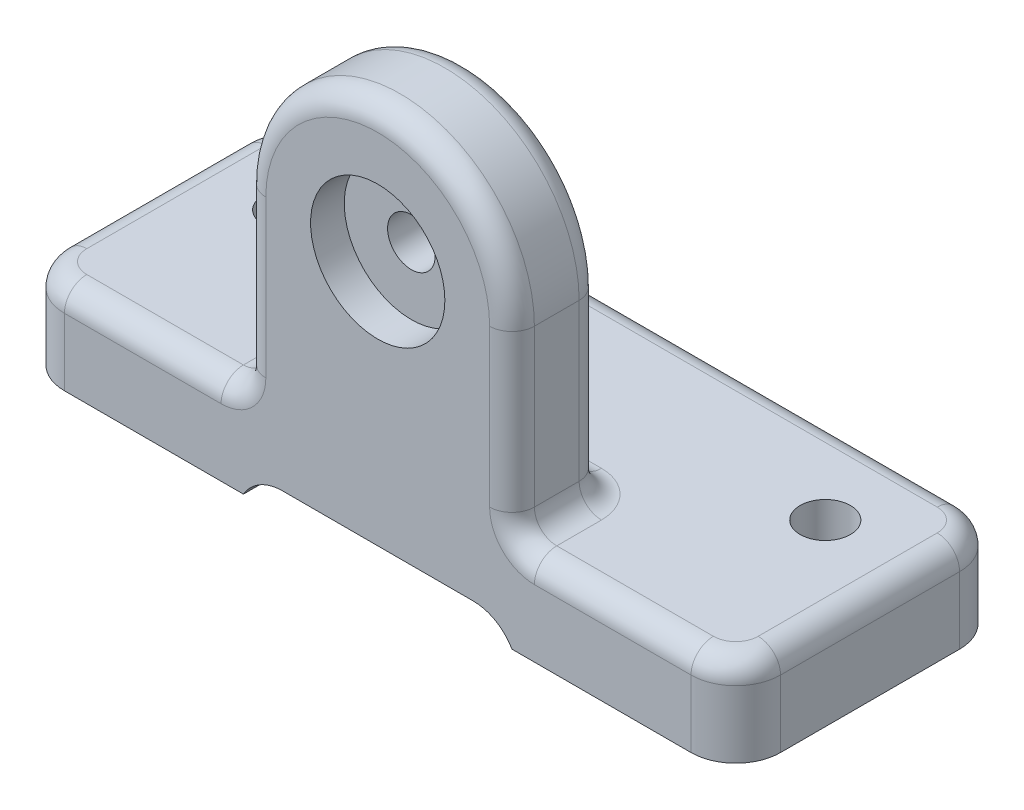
SolidWorks part; units mm, degrees
ref_plane "Front Plane" through (0, 0, 0) normal (0, 0, 1) x (1, 0, 0)
ref_plane "Top Plane" through (0, 0, 0) normal (0, 1, 0) x (1, 0, 0)
ref_plane "Right Plane" through (0, 0, 0) normal (1, 0, 0) x (0, 0, -1)
sketch "Sketch1" plane through (0, 0, 0) normal (0, 1, 0) x (1, 0, 0)
  line L1 (0, 0) -> (101.6, 0)
  line L2 (0, 0) -> (0, 38.1)
  line L3 (0, 38.1) -> (101.6, 38.1)
  line L4 (101.6, 0) -> (101.6, 38.1)
  dimension "D1" = 101.6
  dimension "D2" = 38.1
extrude "Base Plate" add sketch "Sketch1" along normal blind 12.7
sketch "Sketch2" plane through (0, 0, 0) normal (0, 0, 1) x (1, 0, 0)
  line L0 (31.75, 0) -> (31.75, 38.1)
  line L1 (0, 0) -> (101.6, 0) construction
  line L2 (69.85, 38.1) -> (69.85, 0)
  line L3 (69.85, 0) -> (31.75, 0)
  line L4 (0, 12.7) -> (0, 0) construction
  arc A0 (31.75, 38.1) -> (69.85, 38.1) centre (50.8, 38.1) cw
  dimension "D1" = 19.05
  dimension "D2" = 50.8
  dimension "D3" = 38.1
extrude "Vert Boss" add sketch "Sketch2" against normal blind 12.7
hole_wizard "CBORE for 1/4 Hex Head Bolt1" positions "Sketch4" profile "Sketch3" counterbore size "1/4" standard "Ansi Inch"
sketch "Sketch4" plane through (0, 0, 0) normal (0, 0, 1) x (1, 0, 0)
  point P0 (50.8, 38.1)
sketch "Sketch3" plane through (50.8, 38.1, 0) normal (1, 0, 0) x (0, -1, 0)
  line L0 (0, 0) -> (0, 38.1)
  line L1 (0, 38.1) -> (3.3782, 38.1)
  line L3 (3.3782, 38.1) -> (3.3782, 4.7752)
  line L4 (3.3782, 4.7752) -> (9.525, 4.7752)
  line L5 (9.525, 4.7752) -> (9.525, 0)
  line L7 (9.525, 0) -> (0, 0)
  line L11 (0, -6.35) -> (0, 107.95) construction
  dimension "Thru Hole Dia." = 6.7564
  dimension "Thru Hole Depth" = 38.1
  dimension "C'Bore Dia." = 19.05
  dimension "C'Bore Depth" = 4.7752
sketch "Sketch5" plane through (0, 0, 0) normal (0, 0, 1) x (1, 0, 0)
  line L0 (0, 0) -> (101.6, 0) construction
  line L1 (31.75, 0) -> (69.85, 0)
  line L2 (31.75, 0) -> (31.75, 3.175)
  line L3 (31.75, 3.175) -> (69.85, 3.175)
  line L4 (69.85, 0) -> (69.85, 3.175)
  line L5 (31.75, 38.1) -> (31.75, 12.7) construction
  line L6 (69.85, 12.7) -> (69.85, 38.1) construction
  dimension "D1" = 3.175
extrude "Slot" cut sketch "Sketch5" against normal through all
hole_wizard "9/32 Holes" positions "Sketch7" profile "Sketch6" hole size "9/32" standard "Ansi Inch"
sketch "Sketch7" plane through (0, 12.7, 0) normal (0, 1, 0) x (-1, 0, 0)
  line L0 (0, -38.1) -> (0, 0) construction
  line L1 (-101.6, 0) -> (-101.6, -38.1) construction
  line L2 (-101.6, -38.1) -> (0, -38.1) construction
  point P0 (-88.9, -25.4)
  point P1 (-12.7, -25.4)
  dimension "D1" = 12.7
  dimension "D2" = 12.7
  dimension "D3" = 12.7
sketch "Sketch6" plane through (88.9, 12.7, -25.4) normal (1, 0, 0) x (0, 0, 1)
  line L0 (0, 0) -> (0, 12.7)
  line L1 (0, 12.7) -> (3.5719, 12.7)
  line L2 (3.5719, 12.7) -> (3.5719, 0)
  line L5 (3.5719, 0) -> (0, 0)
  line L11 (0, -6.35) -> (0, 107.95) construction
  dimension "Thru Hole Dia." = 7.1437
  dimension "Thru Hole Depth" = 12.7
fillet "Fillet1" radius 6.35 6 edges at (69.85, 3.175, -19.05) (31.75, 3.175, -19.05) (0, 6.35, 0) (0, 6.35, -38.1) (101.6, 6.35, -38.1) (101.6, 6.35, 0)
fillet "Fillet2" radius 3.175 18 edges at (1.8599, 12.7, -36.2401) (0, 12.7, -19.05) (50.8, 12.7, -38.1) (1.8599, 12.7, -1.8599) (99.7401, 12.7, -36.2401) (19.05, 12.7, 0) (101.6, 12.7, -19.05) (31.75, 12.7, -6.35) (99.7401, 12.7, -1.8599) (50.8, 12.7, -12.7) (82.55, 12.7, 0) (69.85, 25.4, -12.7) (31.75, 25.4, -12.7) (69.85, 25.4, 0) (31.75, 25.4, 0) (69.85, 12.7, -6.35) (50.8, 57.15, -12.7) (50.8, 57.15, 0)
